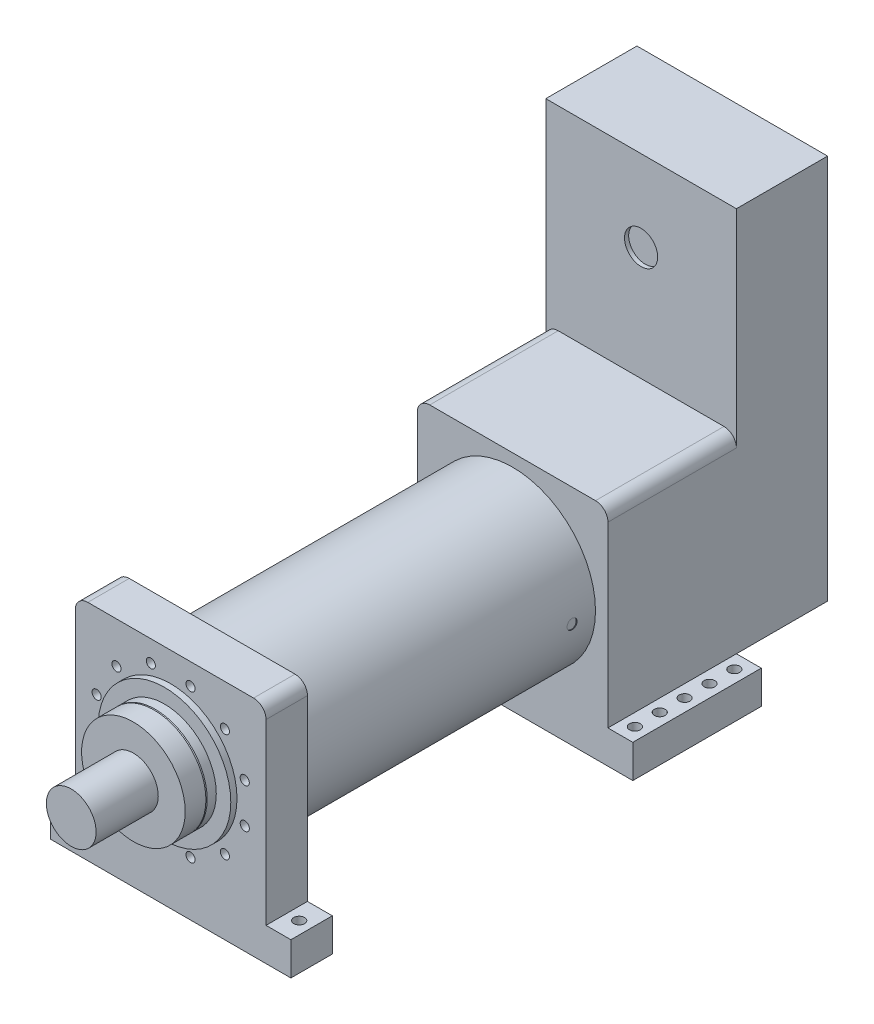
SolidWorks part; units mm, degrees
ref_plane "前视基准面" through (0, 0, 0) normal (0, 0, 1) x (1, 0, 0)
ref_plane "上视基准面" through (0, 0, 0) normal (0, 1, 0) x (1, 0, 0)
ref_plane "右视基准面" through (0, 0, 0) normal (1, 0, 0) x (0, 0, -1)
sketch "草图1" plane through (0, 0, 0) normal (0, 0, 1) x (1, 0, 0)
  circle A0 centre (0, 0) radius 200
  dimension "D1" = 400
extrude "凸台-拉伸1" add sketch "草图1" along normal blind 725
sketch "草图2" plane through (0, 0, 725) normal (0, 0, 1) x (1, 0, 0)
  line L0 (0, 0) -> (351.3656, 0) construction
  line L1 (0, 0) -> (299.4379, 80.2342) construction
  line L3 (-230, 230) -> (230, 230)
  line L4 (-230, 230) -> (-230, -230)
  line L5 (-230, -230) -> (230, -230)
  line L6 (230, 230) -> (230, -230)
  line L7 (-230, 230) -> (230, -230) construction
  line L8 (-230, -230) -> (230, 230) construction
  circle A0 centre (0, 0) radius 230 construction
  circle A1 centre (0, 0) radius 185 construction
  circle A2 centre (178.6963, 47.8815) radius 11
  circle A3 centre (178.6963, -47.8815) radius 11
  circle A4 centre (130.8148, -130.8148) radius 11
  circle A5 centre (47.8815, -178.6963) radius 11
  circle A6 centre (-47.8815, -178.6963) radius 11
  circle A7 centre (-130.8148, -130.8148) radius 11
  circle A8 centre (-178.6963, -47.8815) radius 11
  circle A9 centre (-178.6963, 47.8815) radius 11
  circle A10 centre (-130.8148, 130.8148) radius 11
  circle A11 centre (-47.8815, 178.6963) radius 11
  circle A12 centre (47.8815, 178.6963) radius 11
  circle A13 centre (130.8148, 130.8148) radius 11
  point P32 (0, 0)
  dimension "D1" = 460
  dimension "D2" = 370
  dimension "D4" = 22
  dimension "D3" = 15
  dimension "D6" = 460
  dimension "D7" = 460
  dimension "D5" = 12
extrude "凸台-拉伸2" add sketch "草图2" along normal blind 100
sketch "草图6" plane through (0, 0, 0) normal (0, 0, -1) x (-1, 0, 0)
  line L1 (-230, 230) -> (230, 230)
  line L2 (-230, 230) -> (-230, -230)
  line L3 (-230, -230) -> (230, -230)
  line L4 (230, 230) -> (230, -230)
  line L5 (-230, 230) -> (230, -230) construction
  line L6 (-230, -230) -> (230, 230) construction
  circle A0 centre (0, 0) radius 230 construction
  dimension "D1" = 460
  dimension "D2" = 460
  dimension "D3" = 460
extrude "凸台-拉伸6" add sketch "草图6" along normal blind 310 separate body
ref_plane "基准面1" through (-200, 0, 0) normal (1, 0, 0) x (0, 0, -1)
sketch "草图9" plane through (-200, 0, 0) normal (1, 0, 0) x (0, 0, -1)
  circle A0 centre (-36.5, 0) radius 12
  circle A1 centre (-670.5, 0) radius 12
  dimension "D1" = 24
  dimension "D2" = 24
  dimension "D3" = 36.5
extrude "切除-拉伸2" cut sketch "草图9" along normal blind 2
ref_plane "基准面2" through (200, 0, 0) normal (1, 0, 0) x (0, 0, -1)
sketch "草图10" plane through (200, 0, 0) normal (1, 0, 0) x (0, 0, -1)
  circle A0 centre (-56.5, 0) radius 12
  dimension "D1" = 56.5
  dimension "D2" = 24
extrude "切除-拉伸3" cut sketch "草图10" against normal blind 2
sketch "草图12" plane through (0, 0, -310) normal (0, 0, -1) x (-1, 0, 0)
  line L1 (-230, 700) -> (230, 700)
  line L2 (-230, 700) -> (-230, -230)
  line L3 (-230, -230) -> (230, -230)
  line L4 (230, 700) -> (230, -230)
  line L5 (-230, 700) -> (230, -230) construction
  line L6 (-230, -230) -> (230, 700) construction
  point P0 (0, 235)
  point P5 (0, 150.9292)
  point P6 (0, 0)
  dimension "D1" = 460
  dimension "D2" = 930
  dimension "D3" = 230
extrude "凸台-拉伸9" add sketch "草图12" along normal blind 220
sketch "草图13" plane through (0, 0, -310) normal (0, 0, 1) x (1, 0, 0)
  line L0 (-230, 700) -> (230, 700) construction
  circle A0 centre (0, 504) radius 40
  dimension "D1" = 80
  dimension "D2" = 196
extrude "切除-拉伸5" cut sketch "草图13" against normal blind 10
sketch "草图18" plane through (0, -230, 0) normal (0, -1, 0) x (1, 0, 0)
  line L0 (230, -530) -> (230, -310) construction
  line L1 (-290, -310) -> (290, -310)
  line L2 (-290, -310) -> (-290, 0)
  line L3 (-290, 0) -> (290, 0)
  line L4 (290, -310) -> (290, 0)
  line L5 (0, 0) -> (0, -101.6782) construction
  circle A0 centre (-260, -275) radius 13
  circle A1 centre (-260, -215) radius 13
  circle A2 centre (-260, -155) radius 13
  circle A3 centre (-260, -95) radius 13
  circle A4 centre (-260, -35) radius 13
  circle A5 centre (260, -35) radius 13
  circle A6 centre (260, -95) radius 13
  circle A7 centre (260, -155) radius 13
  circle A8 centre (260, -215) radius 13
  circle A9 centre (260, -275) radius 13
  dimension "D3" = 26
  dimension "D1" = 580
  dimension "D2" = 60
  dimension "D4" = 60
  dimension "D5" = 60
  dimension "D6" = 60
  dimension "D7" = 60
  dimension "D8" = 35
  dimension "D9" = 260
  dimension "D10" = 35
extrude "凸台-拉伸16" add sketch "草图18" along normal blind 80
sketch "草图19" plane through (0, 0, 825) normal (0, 0, 1) x (1, 0, 0)
  circle A0 centre (0, 0) radius 160
  dimension "D1" = 320
extrude "凸台-拉伸17" add sketch "草图19" along normal blind 15
sketch "草图20" plane through (0, 0, 840) normal (0, 0, 1) x (1, 0, 0)
  circle A0 centre (0, 0) radius 125
  dimension "D1" = 250
extrude "凸台-拉伸18" add sketch "草图20" along normal blind 25 separate body
chamfer "倒角1" distance 3 angle 20 1 edges at (125, 0, 865)
sketch "草图21" plane through (0, 0, 865) normal (0, 0, 1) x (1, 0, 0)
  circle A0 centre (0, 0) radius 125
  dimension "D1" = 250
extrude "凸台-拉伸19" add sketch "草图21" along normal blind 50 separate body
sketch "草图22" plane through (0, 0, 915) normal (0, 0, 1) x (1, 0, 0)
  circle A0 centre (0, 0) radius 60
  dimension "D1" = 120
extrude "凸台-拉伸20" add sketch "草图22" along normal blind 150 separate body
sketch "草图23" plane through (0, -230, 0) normal (0, -1, 0) x (1, 0, 0)
  line L0 (230, 825) -> (230, 725) construction
  line L1 (-290, 725) -> (290, 725)
  line L2 (-290, 725) -> (-290, 825)
  line L3 (-290, 825) -> (290, 825)
  line L4 (290, 725) -> (290, 825)
  circle A0 centre (-260, 775) radius 13
  circle A1 centre (260, 775) radius 13
  dimension "D3" = 26
  dimension "D7" = 26
  dimension "D1" = 580
  dimension "D2" = 60
  dimension "D4" = 50
  dimension "D5" = 30
  dimension "D6" = 50
  dimension "D8" = 30
extrude "凸台-拉伸21" add sketch "草图23" along normal blind 80
fillet "圆角2" radius 30 4 edges at (-230, 230, 775) (230, 230, 775) (230, 230, -155) (-230, 230, -155)
